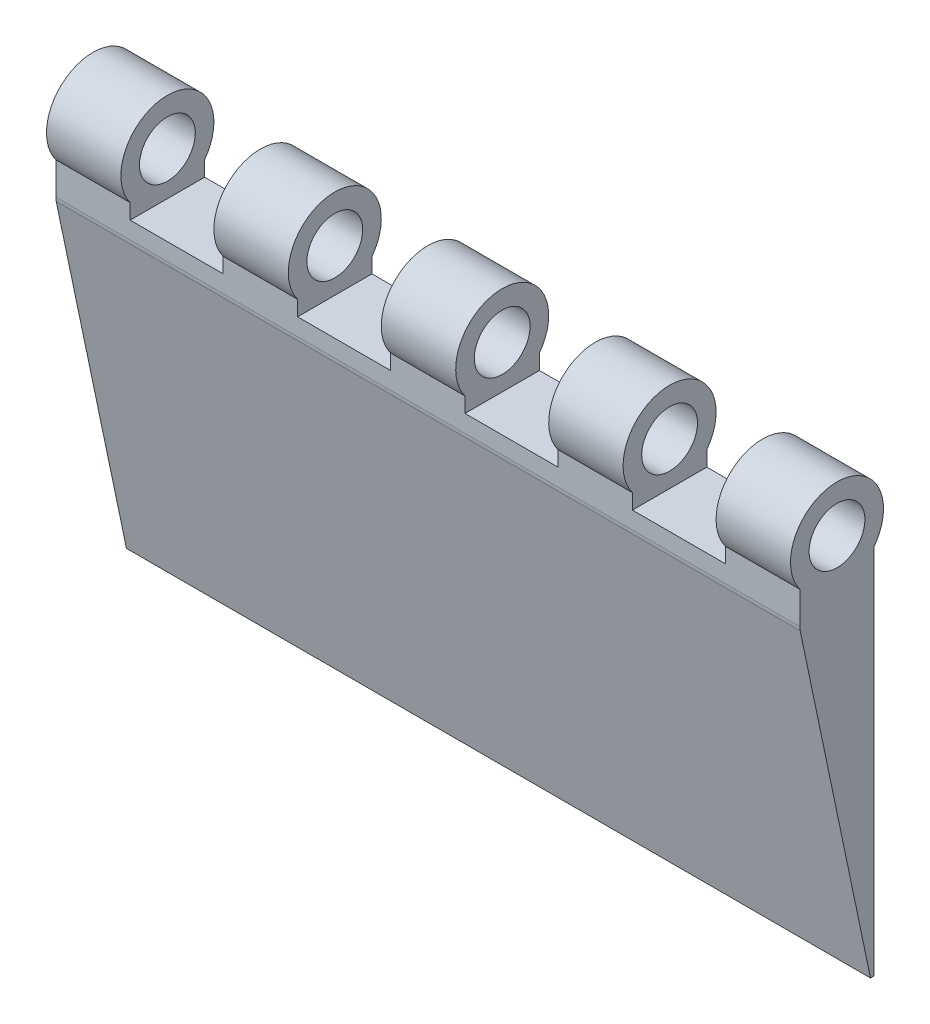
SolidWorks part; units mm, degrees
ref_plane "Front Plane" through (0, 0, 0) normal (0, 0, 1) x (1, 0, 0)
ref_plane "Top Plane" through (0, 0, 0) normal (0, 1, 0) x (1, 0, 0)
ref_plane "Right Plane" through (0, 0, 0) normal (1, 0, 0) x (0, 0, -1)
sketch "Sketch1" plane through (0, 0, 0) normal (1, 0, 0) x (0, 0, -1)
  line L1 (-2, 10) -> (2, 10)
  line L2 (-2, 10) -> (-2, -10)
  line L3 (-2, -10) -> (2, -10)
  line L4 (2, 10) -> (2, -10)
  line L5 (-2, 10) -> (2, -10) construction
  line L6 (-2, -10) -> (2, 10) construction
  point P0 (0, 0)
  dimension "D1" = 4
  dimension "D2" = 20
extrude "Boss-Extrude1" add sketch "Sketch1" along normal blind 40
sketch "Sketch2" plane through (0, 0, 0) normal (-1, 0, 0) x (0, 0, 1)
  circle A0 centre (0, 11.5) radius 2.5
  circle A1 centre (0, 11.5) radius 1.5
  point P2 (0, 0)
  dimension "D1" = 5
  dimension "D2" = 1
extrude "Boss-Extrude3" add sketch "Sketch2" against normal up to surface (40 mm away)
sketch "Sketch3" plane through (0, 0, -2) normal (0, 0, -1) x (-1, 0, 0)
  line L0 (-40, 14) -> (-40, 10) construction
  line L1 (-36, 16.4084) -> (-31, 16.4084)
  line L2 (-36, 16.4084) -> (-36, 9.185)
  line L3 (-36, 9.185) -> (-31, 9.185)
  line L4 (-31, 16.4084) -> (-31, 9.185)
  line L5 (-27, 16.4084) -> (-27, 9.185)
  line L6 (-27, 16.4084) -> (-22, 16.4084)
  line L7 (-22, 16.4084) -> (-22, 9.185)
  line L8 (-27, 9.185) -> (-22, 9.185)
  line L9 (-18, 16.4084) -> (-18, 9.185)
  line L10 (-18, 16.4084) -> (-13, 16.4084)
  line L11 (-13, 16.4084) -> (-13, 9.185)
  line L12 (-18, 9.185) -> (-13, 9.185)
  line L13 (-9, 16.4084) -> (-9, 9.185)
  line L14 (-9, 16.4084) -> (-4, 16.4084)
  line L15 (-4, 16.4084) -> (-4, 9.185)
  line L16 (-9, 9.185) -> (-4, 9.185)
  dimension "D1" = 4
  dimension "D2" = 5
  dimension "D3" = 4
extrude "Cut-Extrude1" cut sketch "Sketch3" against normal through all both and the other way through all
sketch "Sketch4" plane through (0, 0, 0) normal (-1, 0, 0) x (0, 0, 1)
  line L0 (2, 8.1532) -> (-1.8, -10)
  line L1 (-1.8, -10) -> (5.1491, -10)
  line L2 (5.1491, -10) -> (4.6933, 8.1532)
  line L3 (4.6933, 8.1532) -> (2, 8.1532)
  line L4 (2, 10) -> (2, -10) construction
  line L5 (2, -10) -> (-2, -10) construction
  point P4 (0, 0)
  point P7 (0, 0)
  dimension "D1" = 0.2
extrude "Cut-Extrude2" cut sketch "Sketch4" against normal through all
fillet "Fillet1" radius 1 1 edges at (20, 8.1532, 2)
